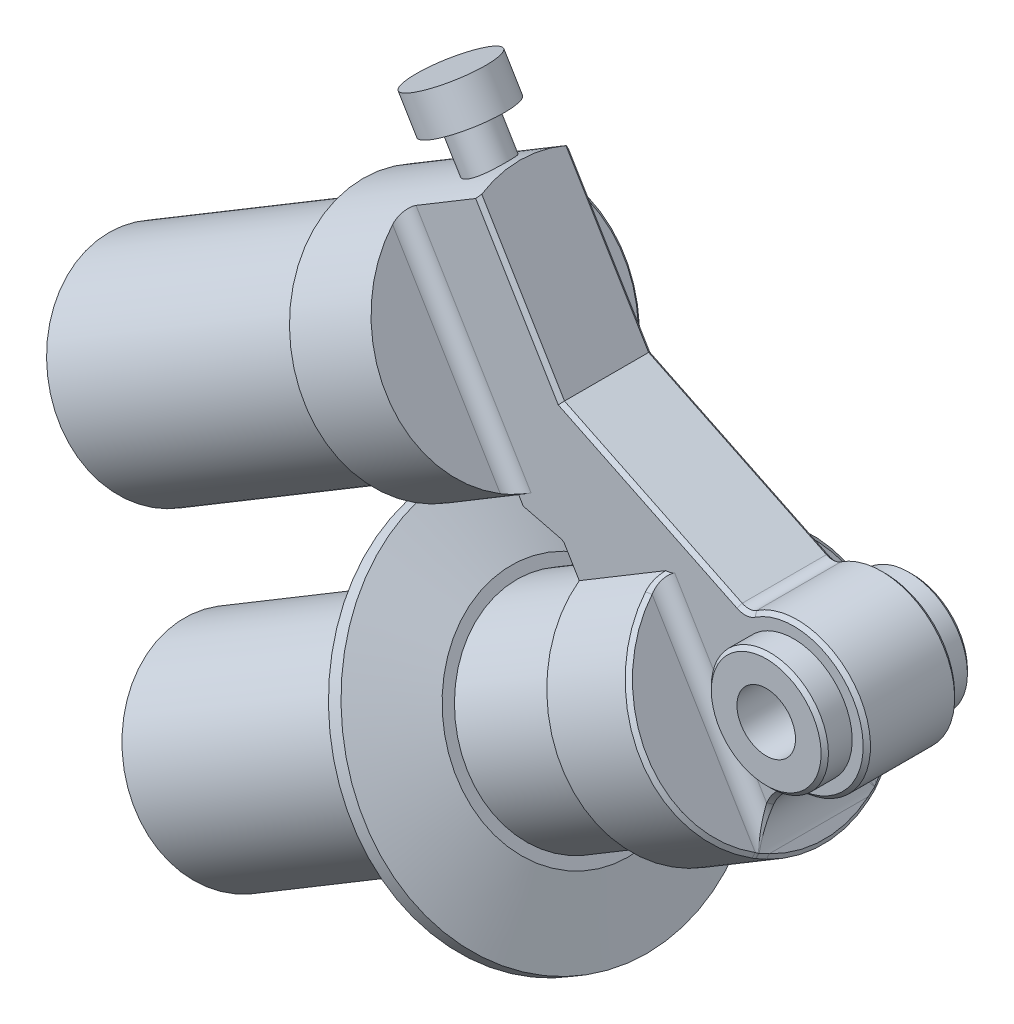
SolidWorks part; units mm, degrees
ref_plane "Face" through (0, 0, 0) normal (0, 0, 1) x (1, 0, 0)
ref_plane "Dessus" through (0, 0, 0) normal (0, 1, 0) x (1, 0, 0)
ref_plane "Droite" through (0, 0, 0) normal (1, 0, 0) x (0, 0, -1)
imported_body "Importée1"
ref_plane "Plan réglage de précontrainte" through (174.9207, 105.0332, 0) normal (-0.8573, -0.5148, 0) x (0, 0, 1)
sketch "Esquisse1" plane through (174.9207, 105.0332, 0) normal (-0.8573, -0.5148, 0) x (0, 0, 1)
  circle A0 centre (0, 219.0913) radius 15.5
  arc A1 (-6.25, 234.3618) -> (6.25, 234.3618) centre (0, 219.0913) ccw construction
  dimension "D1" = 31
extrude "Extrusion1" add sketch "Esquisse1" along normal blind 3 draft 73.3
sketch "Esquisse2" plane through (172.3487, 103.4889, 0) normal (-0.8573, -0.5148, 0) x (0, 0, 1)
  circle A0 centre (0, 219.0913) radius 25.4995
  circle A3 centre (0, 219.0913) radius 25.4995 construction
extrude "Extrusion2" add sketch "Esquisse2" along normal blind 2
sketch "Esquisse3" plane through (117.4804, 70.5425, 0) normal (-0.8573, -0.5148, 0) x (0, 0, 1)
  circle A0 centre (0, 219.0913) radius 14 construction
  circle A1 centre (0, 219.0913) radius 14
extrude "Enlèv. mat.-Extru.1" cut sketch "Esquisse3" against normal blind 14
sketch "Ancrage ressort" plane through (170.6341, 102.4593, 0) normal (-0.8573, -0.5148, 0) x (0, 0, 1)
  point P0 (0, 219.0913)
